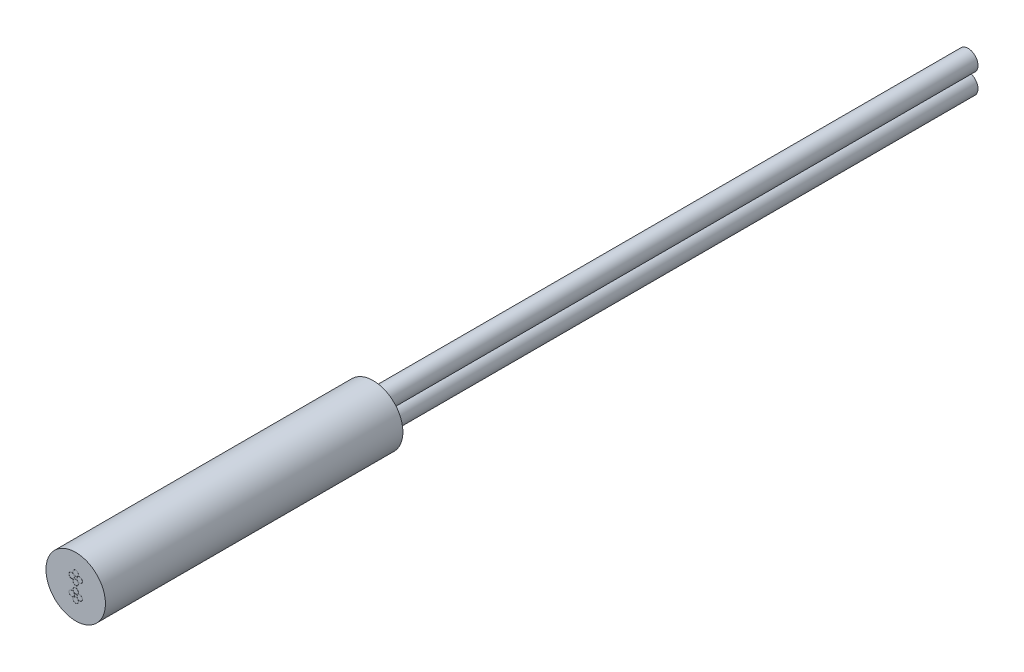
SolidWorks part; units mm, degrees
ref_plane "前视基准面" through (0, 0, 0) normal (0, 0, 1) x (1, 0, 0)
ref_plane "上视基准面" through (0, 0, 0) normal (0, 1, 0) x (1, 0, 0)
ref_plane "右视基准面" through (0, 0, 0) normal (1, 0, 0) x (0, 0, -1)
sketch "草图1" plane through (0, 0, 0) normal (0, 0, 1) x (1, 0, 0)
  circle A0 centre (0, 0) radius 1.5
  dimension "D1" = 3
extrude "凸台-拉伸1" add sketch "草图1" against normal blind 15
sketch "草图2" plane through (0, 0, 0) normal (0, 0, 1) x (1, 0, 0)
  line L0 (1.65, 0) -> (-1.65, 0) construction
  circle A13 centre (0, 0.5906) radius 0.1375
  circle A14 centre (-0.2015, 0.389) radius 0.1375
  circle A15 centre (0.2015, 0.389) radius 0.1375
  circle A16 centre (0, 0.1875) radius 0.1375
  circle A17 centre (0, 0.5906) radius 0.1325
  circle A18 centre (-0.2015, 0.389) radius 0.1325
  circle A19 centre (0, 0.1875) radius 0.1325
  circle A20 centre (0.2015, 0.389) radius 0.1325
  circle A21 centre (0, 0.389) radius 0.339 construction
  circle A22 centre (-0.2015, -0.389) radius 0.1325
  circle A23 centre (-0.2015, -0.389) radius 0.1375
  circle A24 centre (0, -0.1875) radius 0.1325
  circle A25 centre (0, -0.1875) radius 0.1375
  circle A26 centre (0.2015, -0.389) radius 0.1325
  circle A27 centre (0.2015, -0.389) radius 0.1375
  circle A28 centre (0, -0.5906) radius 0.1325
  circle A29 centre (0, -0.5906) radius 0.1375
  circle A30 centre (0, -0.389) radius 0.339 construction
  dimension "D1" = 0.275
  dimension "D2" = 0.265
  dimension "D3" = 0.01
  dimension "D4" = 0.01
  dimension "D5" = 0.01
  dimension "D6" = 0.05
sketch "草图3" plane through (0, 0, -15) normal (0, 0, -1) x (-1, 0, 0)
  circle A0 centre (0, 0.51) radius 0.5
  circle A1 centre (0, -0.51) radius 0.5
  dimension "D1" = 1
  dimension "D2" = 0.01
  dimension "D3" = 0.01
extrude "凸台-拉伸2" add sketch "草图3" along normal blind 30
extrude "切除-拉伸1" cut sketch "草图2" against normal blind 0.1
